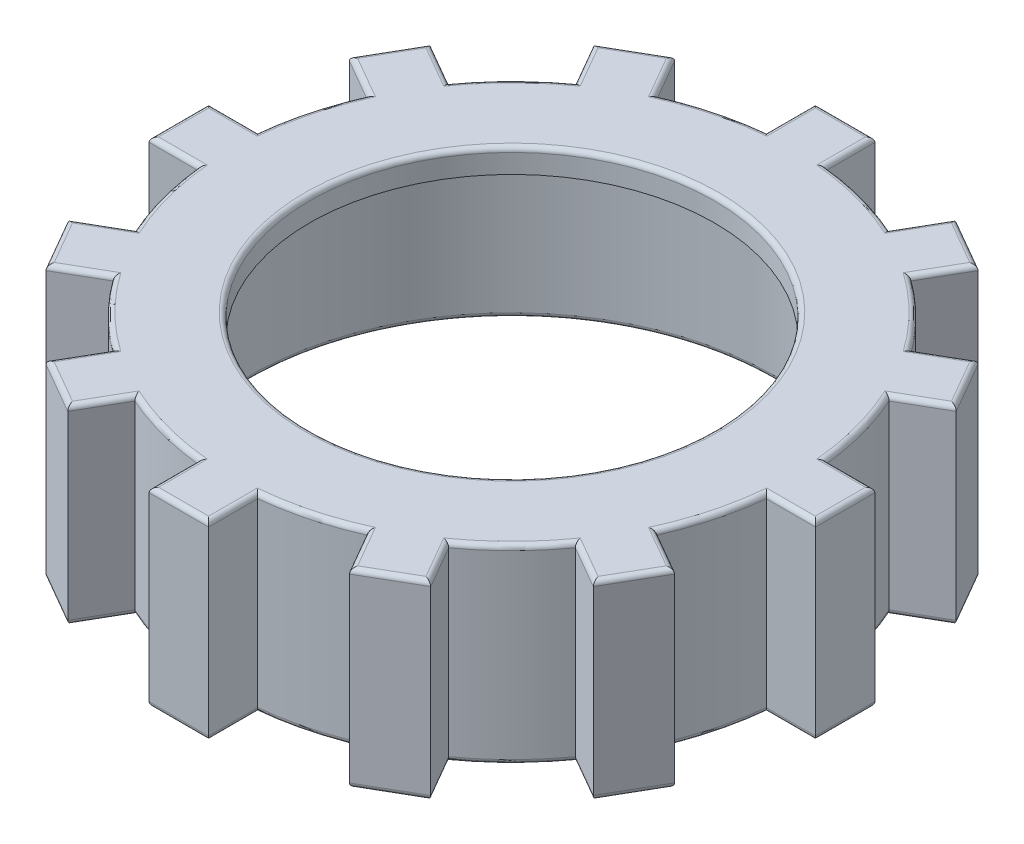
SolidWorks part; units mm, degrees
ref_plane "Face" through (0, 0, 0) normal (0, 0, 1) x (1, 0, 0)
ref_plane "Dessus" through (0, 0, 0) normal (0, 1, 0) x (1, 0, 0)
ref_plane "Droite" through (0, 0, 0) normal (1, 0, 0) x (0, 0, -1)
sketch "Esquisse1" plane through (0, 0, 0) normal (0, 0, 1) x (1, 0, 0)
  line L0 (0, 0) -> (0, 17) construction
  line L1 (-8.5, 8) -> (-12, 8)
  line L2 (-12, 8) -> (-12, 0)
  line L3 (-12, 0) -> (-11, 0)
  line L4 (-11, 0) -> (-11, 7)
  line L5 (-11, 7) -> (-8.5, 7)
  line L6 (-8.5, 7) -> (-8.5, 8)
  dimension "D1" = 22
  dimension "D2" = 24
  dimension "D3" = 7
  dimension "D4" = 17
  dimension "D5" = 8
revolve "Révolution1" add sketch "Esquisse1" angle 360 about L0
sketch "Esquisse2" plane through (0, 0, 0) normal (0, -1, 0) x (1, 0, 0)
  line L0 (0, 0) -> (0, -14) construction
  line L1 (-1.25, -11.9347) -> (-1.25, -14)
  line L2 (1.25, -11.9347) -> (1.25, -14)
  line L3 (-1.25, -14) -> (1.25, -14)
  circle A0 centre (0, 0) radius 12 construction
  arc A1 (-1.25, -11.9347) -> (1.25, -11.9347) centre (0, 0) ccw
  dimension "D1" = 2.5
  dimension "D2" = 14
extrude "Extrusion1" add sketch "Esquisse2" against normal up to surface (8 mm away)
pattern_circular "Répétition circulaire1" count 12 over 360 about axis through (0, 0, 0) along (0, 1, 0)
fillet "Congé1" radius 0.2
